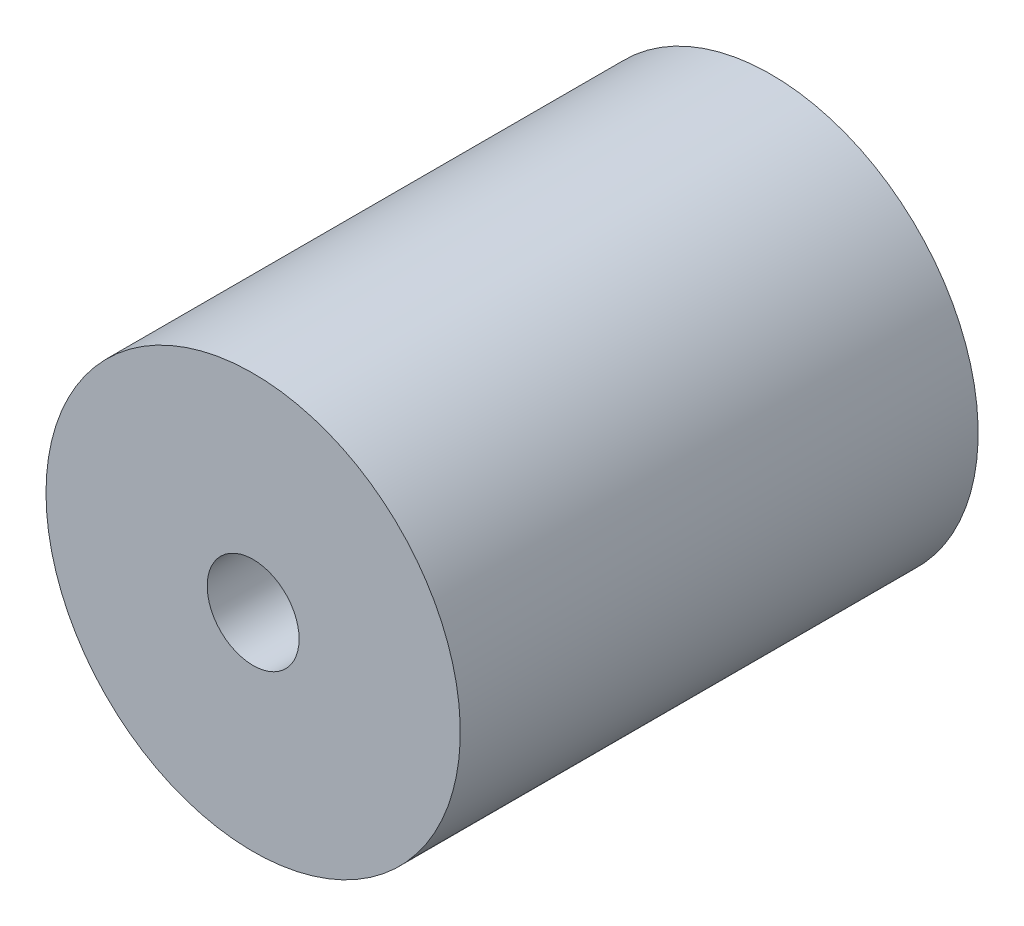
SolidWorks part; units mm, degrees
ref_plane "Front Plane" through (0, 0, 0) normal (0, 0, 1) x (1, 0, 0)
ref_plane "Top Plane" through (0, 0, 0) normal (0, 1, 0) x (1, 0, 0)
ref_plane "Right Plane" through (0, 0, 0) normal (1, 0, 0) x (0, 0, -1)
sketch "Sketch1" plane through (0, 0, 0) normal (0, 0, 1) x (1, 0, 0)
  circle A0 centre (0, 0) radius 6.096
  dimension "D1" = 12.192
extrude "Extrude1" add sketch "Sketch1" along normal blind 15.24
hole_wizard "#6-32 Tapped Hole1" positions "3DSketch1" profile "Sketch2" tap size "#6-32" standard "Ansi Inch"
sketch3d "3DSketch1"
  line L0 (0, 0, 15.24) -> (0, 0, 0) construction
  point P0 (0, 0, 0)
  point P4 (0, 0, 15.24)
sketch "Sketch2" plane through (0, 0, 15.24) normal (1, 0, 0) x (0, -1, 0)
  line L0 (0, 0) -> (0, 7.1627)
  line L1 (0, 7.1627) -> (1.3525, 6.35)
  line L2 (1.3525, 6.35) -> (1.3525, 0)
  line L5 (1.3525, 0) -> (0, 0)
  line L10 (0, 7.1627) -> (-1.3526, 6.35) construction
  line L11 (0, -6.35) -> (0, 107.95) construction
  dimension "Tap Drill Dia." = 2.7051
  dimension "Tap Drill Depth" = 6.35
  dimension "Drill Angle" = 118
hole_wizard "#10-32 Tapped Hole1" positions "3DSketch2" profile "Sketch3" tap size "#10-32" standard "Ansi Inch"
sketch3d "3DSketch2"
  circle A0 centre (0, 0, 0) radius 6.35
  point P7 (0, 0, 6.35)
  point P15 (0, 0, 0)
  dimension "D1" = 0
sketch "Sketch3" plane through (0, 0, 0) normal (1, 0, 0) x (0, 1, 0)
  line L0 (0, 0) -> (0, 8.8333)
  line L1 (0, 8.8333) -> (2.0193, 7.62)
  line L2 (2.0193, 7.62) -> (2.0193, 0)
  line L5 (2.0193, 0) -> (0, 0)
  line L10 (0, 8.8333) -> (-2.0193, 7.62) construction
  line L11 (0, -6.35) -> (0, 107.95) construction
  dimension "Tap Drill Dia." = 4.0386
  dimension "Tap Drill Depth" = 7.62
  dimension "Drill Angle" = 118
